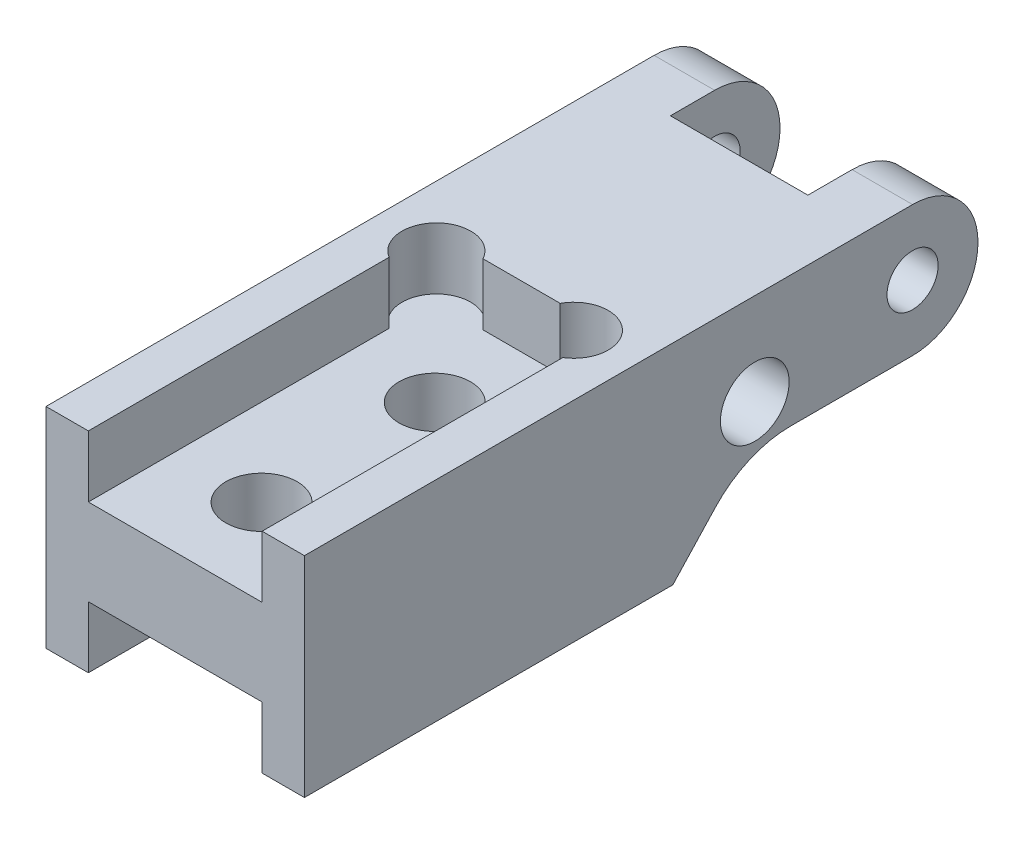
SolidWorks part; units mm, degrees
ref_plane "Front/Back" through (0, 0, 0) normal (0, 0, 1) x (1, 0, 0)
ref_plane "Top/Bottom" through (0, 0, 0) normal (0, 1, 0) x (1, 0, 0)
ref_plane "Right/Left" through (0, 0, 0) normal (1, 0, 0) x (0, 0, -1)
sketch "Sketch1" plane through (0, 0, 0) normal (0, 1, 0) x (1, 0, 0)
  line L0 (0, 0) -> (5.969, 0) construction
  line L1 (-5.969, 15.5575) -> (5.969, 15.5575)
  line L2 (-5.969, 15.5575) -> (-5.969, -15.5575)
  line L3 (-5.969, -15.5575) -> (5.969, -15.5575)
  line L4 (5.969, 15.5575) -> (5.969, -15.5575)
  line L5 (0, 0) -> (0, 15.5575) construction
  dimension "D1" = 11.938
  dimension "D2" = 31.115
extrude "Extrude1" add sketch "Sketch1" along normal mid plane 9.6774
sketch "Sketch2" plane through (5.969, 0, 0) normal (1, 0, 0) x (0, 0, -1)
  line L0 (-15.5575, 4.8387) -> (15.5575, 4.8387) construction
  line L2 (-15.5575, 4.8387) -> (-15.5575, -4.8387) construction
  line L4 (12.5349, -1.2065) -> (6.9095, -1.2065)
  line L5 (1.4605, -4.8387) -> (3.4192, -2.7288)
  line L6 (-15.5575, -4.8387) -> (15.5575, -4.8387) construction
  line L11 (-15.5575, -4.8387) -> (15.5575, -4.8387)
  line L12 (15.5575, -4.8387) -> (15.5575, 4.8387)
  line L13 (15.5575, 4.8387) -> (-15.5575, 4.8387)
  line L14 (-15.5575, 4.8387) -> (-15.5575, -4.8387)
  line L15 (1.4605, -4.8387) -> (15.5575, -4.8387)
  line L16 (15.5575, -4.8387) -> (15.5575, 1.8161)
  arc A0 (12.5349, -1.2065) -> (15.5575, 1.8161) centre (12.5349, 1.8161) ccw
  arc A1 (6.9095, -1.2065) -> (3.4192, -2.7288) centre (6.9095, -5.969) ccw
  dimension "D2" = 28.0924
  dimension "D4" = 47.129
  dimension "D5" = 17.018
  dimension "D6" = 0
  dimension "D3" = 9.525
  dimension "D7" = 3.0226
extrude "Cut-Extrude6" cut sketch "Sketch2" against normal through all
fillet "Fillet1" radius 3.0226 1 edges at (0, 4.8387, -15.5575)
sketch "Sketch3" plane through (5.969, 0, 0) normal (1, 0, 0) x (0, 0, -1)
  line L0 (-15.5575, 4.8387) -> (-15.5575, -4.8387) construction
  circle A0 centre (12.5349, 1.8161) radius 1.1811
  arc A1 (12.5349, -1.2065) -> (15.5575, 1.8161) centre (12.5349, 1.8161) ccw construction
  dimension "D1" = 2.3622
  dimension "D2" = 28.0924
extrude "Cut-Extrude7" cut sketch "Sketch3" against normal through all
sketch "Sketch4" plane through (5.969, 0, 0) normal (1, 0, 0) x (0, 0, -1)
  line L0 (-15.5575, 4.8387) -> (12.5349, 4.8387) construction
  line L1 (-15.5575, 4.8387) -> (-15.5575, -4.8387) construction
  circle A0 centre (5.2451, 0.5969) radius 1.5875
  dimension "D1" = 3.175
  dimension "D2" = 4.2418
  dimension "D3" = 20.8026
extrude "Cut-Extrude8" cut sketch "Sketch4" against normal through all
sketch "Sketch5" plane through (0, 0, 0) normal (1, 0, 0) x (0, 0, -1)
  line L0 (0, 0) -> (0, 8.6922) construction
  line L1 (0, 0) -> (15.9761, 0) construction
  line L2 (-15.5575, 4.8387) -> (-15.5575, -4.8387) construction
  line L3 (-15.5575, 4.8387) -> (12.5349, 4.8387) construction
  line L4 (5.5911, -3.6512) -> (11.36, 6.3409)
  line L5 (9.7155, -10.795) -> (19.9273, -10.795)
  line L6 (19.9273, -10.795) -> (14.998, 6.3409)
  line L7 (11.36, 6.3409) -> (14.998, 6.3409)
  arc A0 (5.5911, -3.6512) -> (9.7155, -10.795) centre (9.7155, -6.0325) ccw
  dimension "D1" = 9.525
  dimension "D2" = 25.273
  dimension "D3" = 10.8712
  dimension "D4" = 30
  dimension "D5" = 3.638
  dimension "D6" = 17.1359
  dimension "D7" = 286.048
extrude "Cut-Extrude9" cut sketch "Sketch5" against normal mid plane 6.35
sketch "Sketch6" plane through (0, -4.8387, 0) normal (0, -1, 0) x (1, 0, 0)
  line L0 (0, 0) -> (0, 18.3527) construction
  line L1 (0, 0) -> (8.1641, 0) construction
  line L2 (-5.969, 15.5575) -> (5.969, 15.5575) construction
  line L3 (4.0132, 15.5575) -> (-4.0132, 15.5575)
  line L4 (4.0132, 15.5575) -> (4.0132, -0.4445)
  line L5 (4.0132, -0.4445) -> (-4.0132, -0.4445)
  line L6 (-4.0132, 15.5575) -> (-4.0132, -0.4445)
  dimension "D1" = 8.0264
  dimension "D2" = 16.002
extrude "(Key Pocket)" cut sketch "Sketch6" against normal blind 2.8448
sketch "Sketch7" plane through (0, 4.8387, 0) normal (0, 1, 0) x (-1, 0, 0)
  line L0 (0, 0) -> (0, 16.1962) construction
  line L1 (5.969, 15.5575) -> (-5.969, 15.5575) construction
  line L2 (-4.0132, 15.5575) -> (4.0132, 15.5575)
  line L3 (-4.0132, 15.5575) -> (-4.0132, -0.4445)
  line L4 (-4.0132, -0.4445) -> (4.0132, -0.4445)
  line L5 (4.0132, 15.5575) -> (4.0132, -0.4445)
  line L6 (-4.0132, -0.4445) -> (-4.0132, 15.5575) construction
  line L7 (4.0132, 15.5575) -> (4.0132, -0.4445) construction
  line L8 (4.0132, -0.4445) -> (-4.0132, -0.4445) construction
extrude "(Key Pocket )" cut sketch "Sketch7" against normal blind 2.8448
sketch "Sketch8" plane through (0, 4.8387, 0) normal (0, 1, 0) x (-1, 0, 0)
  line L0 (4.0132, 15.5575) -> (-4.0132, 15.5575) construction
  line L1 (0, 0) -> (0, 17.0764) construction
  circle A0 centre (-3.175, 0.3175) radius 1.5875
  circle A1 centre (3.175, 0.3175) radius 1.5875
  dimension "D3" = 3.175
  dimension "D1" = 15.24
  dimension "D2" = 3.175
extrude "Cut-Extrude12" cut sketch "Sketch8" against normal up to surface (2.8448 mm away)
sketch "Sketch9" plane through (0, -4.8387, 0) normal (0, -1, 0) x (1, 0, 0)
  line L0 (0, 0) -> (0, 16.9444) construction
  line L1 (4.0132, 15.5575) -> (-4.0132, 15.5575) construction
  circle A0 centre (3.175, 0.3175) radius 1.5875
  circle A1 centre (-3.175, 0.3175) radius 1.5875
  dimension "D1" = 3.175
  dimension "D2" = 3.175
  dimension "D3" = 15.24
extrude "Cut-Extrude13" cut sketch "Sketch9" against normal up to surface (2.8448 mm away)
hole_wizard "M4 X .7 (Finger Mount Holes)" positions "Sketch11" profile "Sketch10" tap size "M4x0.7" standard "ANSI Metric"
sketch "Sketch11" plane through (0, -1.9939, 0) normal (0, -1, 0) x (1, 0, 0)
  line L0 (0, 0) -> (0, 16.3748) construction
  line L1 (4.0132, 15.5575) -> (-4.0132, 15.5575) construction
  point P0 (0, 3.5687)
  point P1 (0, 11.5697)
  dimension "D1" = 8.001
  dimension "D2" = 3.9878
sketch "Sketch10" plane through (0, -1.9939, 3.5687) normal (1, 0, 0) x (0, 0, -1)
  line L0 (0, 0) -> (0, 6.8326)
  line L1 (0, 6.8326) -> (1.65, 6.8326)
  line L2 (1.65, 6.8326) -> (1.65, 0)
  line L5 (1.65, 0) -> (0, 0)
  line L11 (0, -6.35) -> (0, 107.95) construction
  dimension "Thru Tap Drill Dia." = 3.3
  dimension "Thru Tap Drill Depth" = 6.8326
